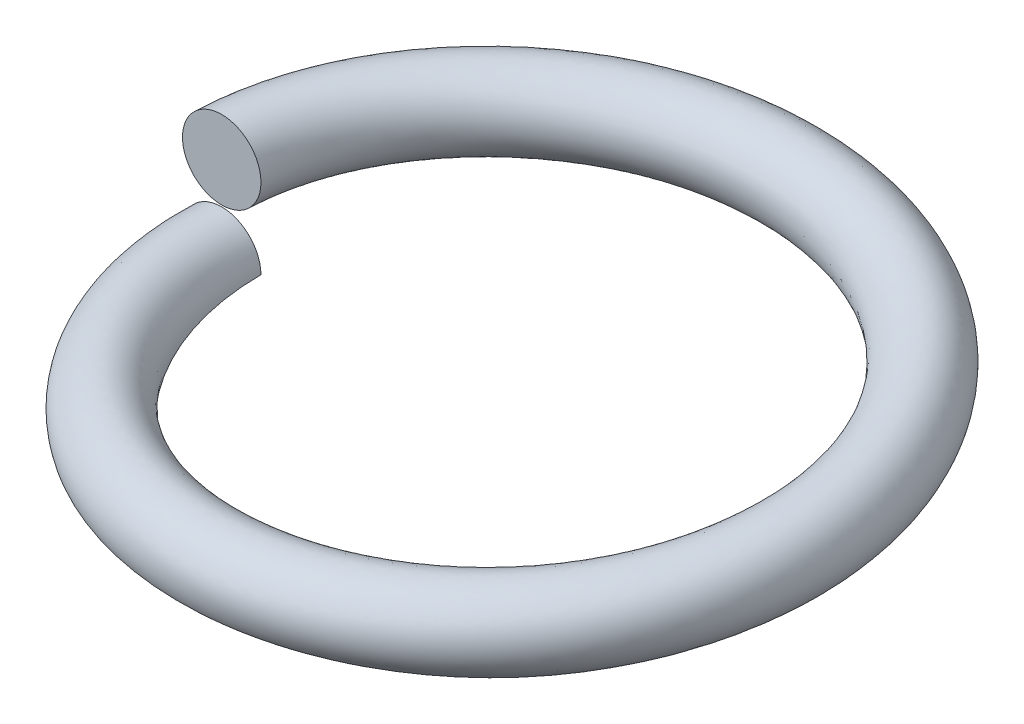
SolidWorks part; units mm, degrees
ref_plane "Ebene vorne" through (0, 0, 0) normal (0, 0, 1) x (1, 0, 0)
ref_plane "Ebene oben" through (0, 0, 0) normal (0, 1, 0) x (1, 0, 0)
ref_plane "Ebene rechts" through (0, 0, 0) normal (1, 0, 0) x (0, 0, -1)
sketch "Skizze1" plane through (0, 0, 0) normal (0, 0, 1) x (1, 0, 0)
  line L0 (0, 0) -> (0, 5.1) construction
  circle A0 centre (-18.5, 0) radius 2.5
  dimension "D1" = 5
  dimension "D3" = 5.1
  dimension "D2" = 37
sketch "Skizze2" plane through (0, 0, 0) normal (0, 0, 1) x (1, 0, 0)
  line L0 (0, 0) -> (0, 5.1) construction
  line L1 (0, 0) -> (0, 5.1)
sweep "Austragung1" add profiles "Skizze1" path "Skizze2" parameters "D4"=360
other "Oberflächenschnitt1"
